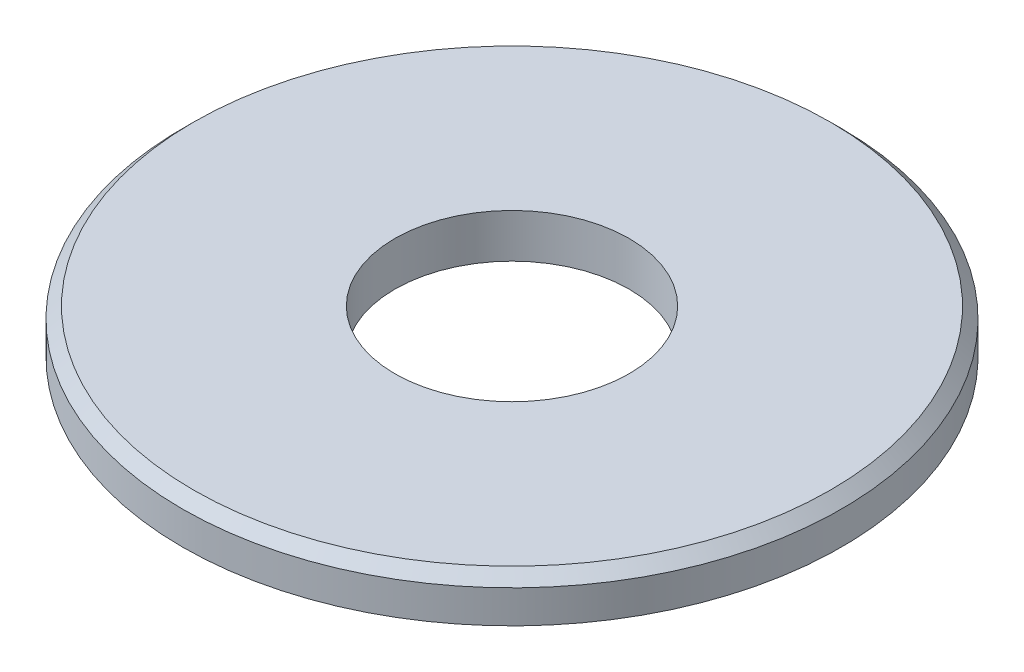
SolidWorks part; units mm, degrees
ref_plane "Face" through (0, 0, 0) normal (0, 0, 1) x (1, 0, 0)
ref_plane "Dessus" through (0, 0, 0) normal (0, 1, 0) x (1, 0, 0)
ref_plane "Droite" through (0, 0, 0) normal (1, 0, 0) x (0, 0, -1)
sketch "Esquisse1" plane through (0, 0, 0) normal (0, 1, 0) x (1, 0, 0)
  circle A0 centre (0, 0) radius 9
  circle A1 centre (0, 0) radius 3.2
  dimension "D1" = 18
  dimension "D2" = 6.4
extrude "Base-Extrusion" add sketch "Esquisse1" along normal blind 1.2
chamfer "Chanfrein3" distance 0.3 angle 45 1 edges at (0, 1.2, 9)
equation "\"Ch@Chanfrein3\" = \"e@Base-Extrusion\" / 4"
